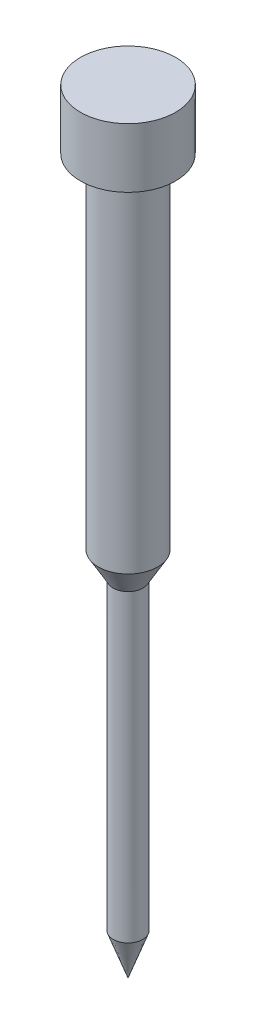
SolidWorks part; units mm, degrees
ref_plane "前视基准面" through (0, 0, 0) normal (0, 0, 1) x (1, 0, 0)
ref_plane "上视基准面" through (0, 0, 0) normal (0, 1, 0) x (1, 0, 0)
ref_plane "右视基准面" through (0, 0, 0) normal (1, 0, 0) x (0, 0, -1)
sketch "草图1" plane through (0, 0, 0) normal (0, 0, 1) x (1, 0, 0)
  line L0 (0, 0) -> (-1.25, 3.4343)
  line L1 (0, 65) -> (0, 0)
  line L2 (-1.25, 29) -> (-2.5, 31.1651)
  line L3 (-1.25, 3.4343) -> (-1.25, 29)
  line L5 (-4, 60) -> (-2.5, 60)
  line L6 (-4, 65) -> (0, 65)
  line L7 (-4, 60) -> (-4, 65)
  line L8 (-2.5, 31.1651) -> (-2.5, 60)
  line L9 (0, 0) -> (0, 69.1426) construction
revolve "旋转1" add sketch "草图1" angle 360 about L9
